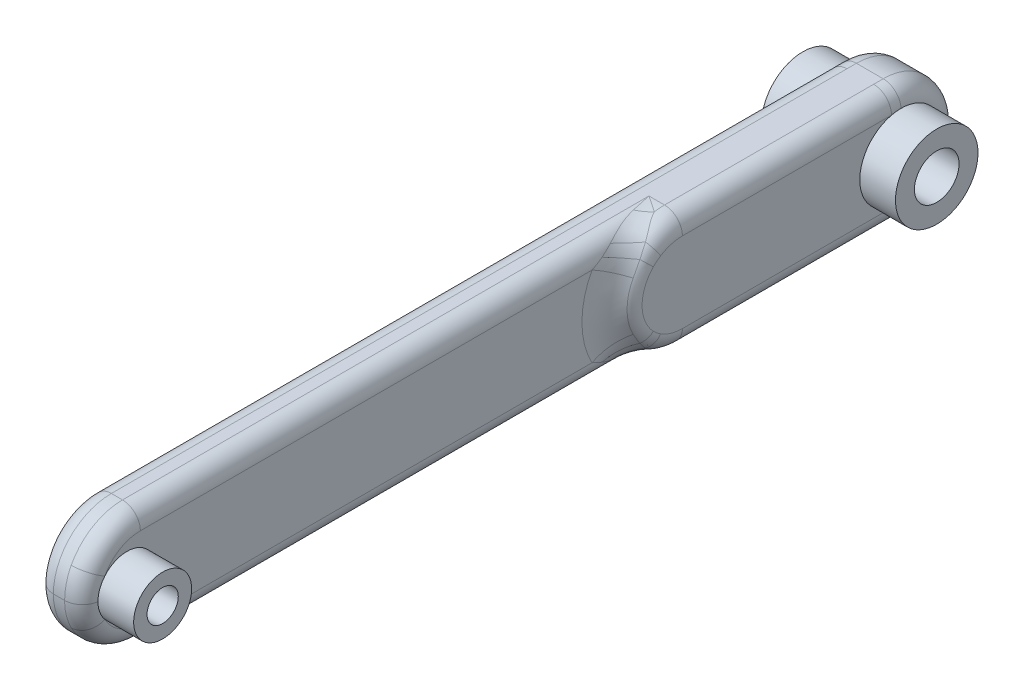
SolidWorks part; units mm, degrees
ref_plane "Front Plane" through (0, 0, 0) normal (0, 0, 1) x (1, 0, 0)
ref_plane "Top Plane" through (0, 0, 0) normal (0, 1, 0) x (1, 0, 0)
ref_plane "Right Plane" through (0, 0, 0) normal (1, 0, 0) x (0, 0, -1)
sketch "Sketch1" plane through (0, 0, 0) normal (1, 0, 0) x (0, 0, -1)
  line L0 (0, 0) -> (0, -6) construction
  line L1 (0, 0) -> (0, 6) construction
  line L2 (0, -6.5) -> (-90, -6.5)
  line L3 (-90, 6.5) -> (0, 6.5)
  line L4 (-90, -6.5) -> (-90, 6.5)
  line L5 (-90, 0) -> (-85, 0) construction
  circle A0 centre (0, 0) radius 3 construction
  arc A2 (0, -6.5) -> (0, 6.5) centre (0, 0) ccw
  circle A4 centre (-85, 0) radius 1.75
  dimension "D1" = 6
  dimension "D2" = 13
  dimension "D3" = 90
  dimension "D7" = 5
  dimension "D8" = 3.5
extrude "Boss-Extrude1" add sketch "Sketch1" along normal blind 7
sketch "Sketch25" plane through (0, 0, 0) normal (-1, 0, 0) x (0, 0, 1)
  circle A0 centre (85, 0) radius 3
  dimension "D1" = 6
extrude "Cut-Extrude5" cut sketch "Sketch25" against normal blind 2
sketch "Sketch26" plane through (7, 0, 0) normal (1, 0, 0) x (0, 0, -1)
  circle A0 centre (-85, 0) radius 3.25
  dimension "D1" = 6.5
extrude "Boss-Extrude11" add sketch "Sketch26" along normal blind 2.25
sketch "Sketch27" plane through (7, 0, 0) normal (-1, 0, 0) x (0, 0, 1)
  circle A0 centre (85, 0) radius 1.75
  circle A1 centre (85, 0) radius 1.75 construction
extrude "Cut-Extrude6" cut sketch "Sketch27" against normal up to next
fillet "Fillet1" radius 6.5 2 edges at (3.5, 6.5, 90) (3.5, -6.5, 90)
sketch "Sketch33" plane through (7, 0, 0) normal (1, 0, 0) x (0, 0, -1)
  circle A0 centre (0, 0) radius 4.625
  dimension "D1" = 9.25
extrude "Boss-Extrude13" add sketch "Sketch33" along normal blind 4
sketch "Sketch34" plane through (0, 0, 0) normal (-1, 0, 0) x (0, 0, 1)
  circle A0 centre (0, 0) radius 4.625
  circle A1 centre (0, 0) radius 4.625 construction
extrude "Boss-Extrude14" add sketch "Sketch34" along normal blind 4
sketch "Sketch35" plane through (7, 0, 0) normal (1, 0, 0) x (0, 0, -1)
  line L0 (0, 0) -> (-18, 0) construction
  line L1 (-18, 0) -> (-24.5036, 0) construction
  line L2 (0, 6.5) -> (-83.5, 6.5)
  line L3 (-83.5, -6.5) -> (0, -6.5)
  line L4 (-24.5036, 6.5) -> (-83.5, 6.5)
  line L5 (-83.5, -6.5) -> (-24.5036, -6.5)
  arc A0 (-24.5036, 6.5) -> (-24.5036, -6.5) centre (-24.5036, 0) ccw
  arc A3 (-83.5, 6.5) -> (-90, 0) centre (-83.5, 0) ccw
  arc A4 (-90, 0) -> (-83.5, -6.5) centre (-83.5, 0) ccw
  arc A5 (0, -6.5) -> (0, 6.5) centre (0, 0) ccw
  arc A6 (-83.5, 6.5) -> (-90, 0) centre (-83.5, 0) ccw
  arc A7 (-90, 0) -> (-83.5, -6.5) centre (-83.5, 0) ccw
  dimension "D3" = 6.5
  dimension "D2" = 18
  dimension "D1" = 0
extrude "Cut-Extrude7" cut sketch "Sketch35" against normal blind 1.75
sketch "Sketch36" plane through (7, 0, 0) normal (-1, 0, 0) x (0, 0, 1)
  circle A0 centre (85, 0) radius 1.75
  circle A1 centre (85, 0) radius 3.25
  circle A3 centre (85, 0) radius 3.25
  circle A4 centre (85, 0) radius 1.75 construction
  dimension "D1" = 0
extrude "Boss-Extrude15" add sketch "Sketch36" along normal blind 2.5
fillet "Fillet3" radius 2 8 edges at (5.25, 6.5, 54.0018) (5.25, 4.5962, 88.0962) (5.25, -4.5962, 88.0962) (0, -6.5, 41.75) (0, -4.5962, 88.0962) (0, 4.5962, 88.0962) (5.25, -6.5, 54.0018) (0, 6.5, 41.75)
sketch "Sketch40" plane through (11, 0, 0) normal (1, 0, 0) x (0, 0, -1)
  line L0 (0, 0) -> (4.625, 0) construction
  circle A0 centre (0, 0) radius 2.5
  circle A1 centre (0, 0) radius 4.625 construction
  point P3 (0, 0)
  dimension "D1" = 5
extrude "Cut-Extrude11" cut sketch "Sketch40" against normal through all
fillet "Fillet4" radius 2 3 edges at (7, -6.5, 12.2518) (7, 0, 31.0036) (7, 6.5, 12.2518)
fillet "Fillet5" radius 6 5 edges at (4.3821, -6.1487, 26.6115) (4.3821, 6.1487, 26.6115) (5.25, 0, 31.0036)
